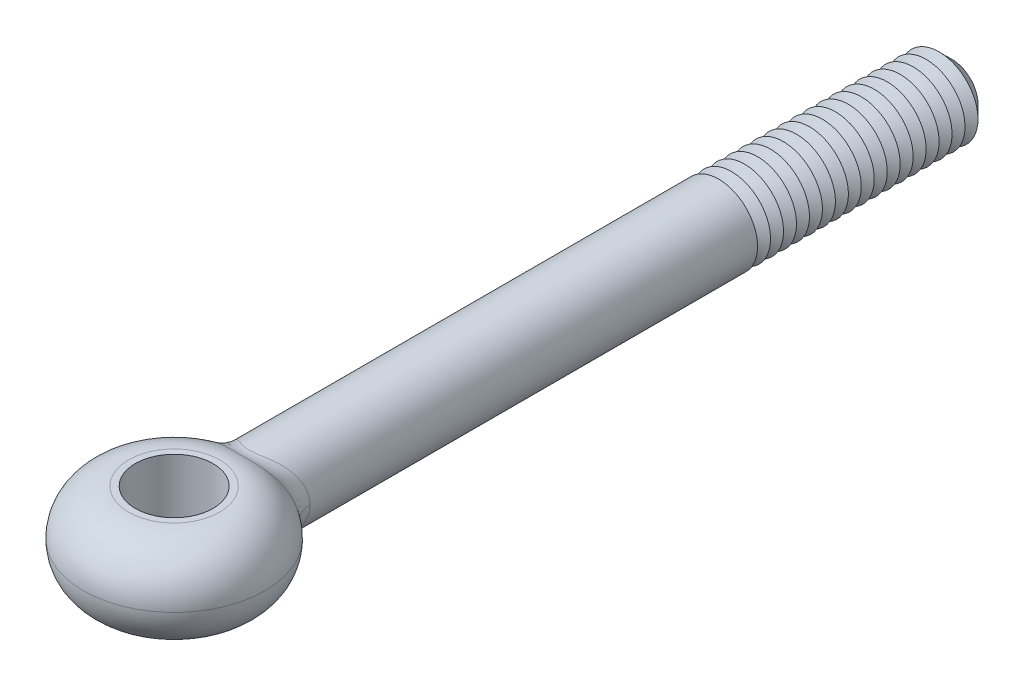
SolidWorks part; units mm, degrees
ref_plane "Front Plane" through (0, 0, 0) normal (0, 0, 1) x (1, 0, 0)
ref_plane "Top Plane" through (0, 0, 0) normal (0, 1, 0) x (1, 0, 0)
ref_plane "Right Plane" through (0, 0, 0) normal (1, 0, 0) x (0, 0, -1)
sketch "Sketch7" plane through (0, 0, 0) normal (0, 1, 0) x (1, 0, 0)
  circle A0 centre (0, 0) radius 7
  dimension "D1" = 14
extrude "Boss-Extrude3" add sketch "Sketch7" along normal mid plane 7
sketch "Sketch8" plane through (0, 0, 0) normal (0, 0, 1) x (1, 0, 0)
  circle A0 centre (0, 0) radius 3
  dimension "D1" = 6
extrude "Boss-Extrude4" add sketch "Sketch8" against normal blind 60
fillet "Fillet5" radius 3.5 2 edges at (0, -3.5, 7) (0, 3.5, 7)
fillet "Fillet6" radius 2 2 edges at (0.1487, -2.9963, -5.3068) (-0.1487, 2.9963, -5.3068)
chamfer "Chamfer1" distance 1 angle 45 1 edges at (3, 0, -60)
sketch "Sketch10" plane through (0, 0, 0) normal (0, 1, 0) x (1, 0, 0)
  line L0 (0, 28.1405) -> (0, -7.9233) construction
sketch "Sketch11" plane through (0, 0, 0) normal (0, 1, 0) x (1, 0, 0)
  line L0 (-3, 42) -> (-2.134, 42.5)
  line L1 (-3, 59) -> (-3, 7.4833) construction
  line L2 (-2.134, 42.5) -> (-3, 43)
  line L3 (-3, 43) -> (-3, 42)
  line L4 (2, 60) -> (-2, 60) construction
  dimension "D1" = 1
  dimension "D2" = 18
revolve "Cut-Revolve1" cut sketch "Sketch11" angle 360 about L0
pattern_linear "LPattern1" count 17 spacing 1 along (0, 0, -1) of "Cut-Revolve1"
sketch "Sketch12" plane through (0, 0, 0) normal (0, 1, 0) x (1, 0, 0)
  circle A0 centre (0, 0) radius 3
  dimension "D1" = 6
extrude "Cut-Extrude1" cut sketch "Sketch12" against normal mid plane 7
